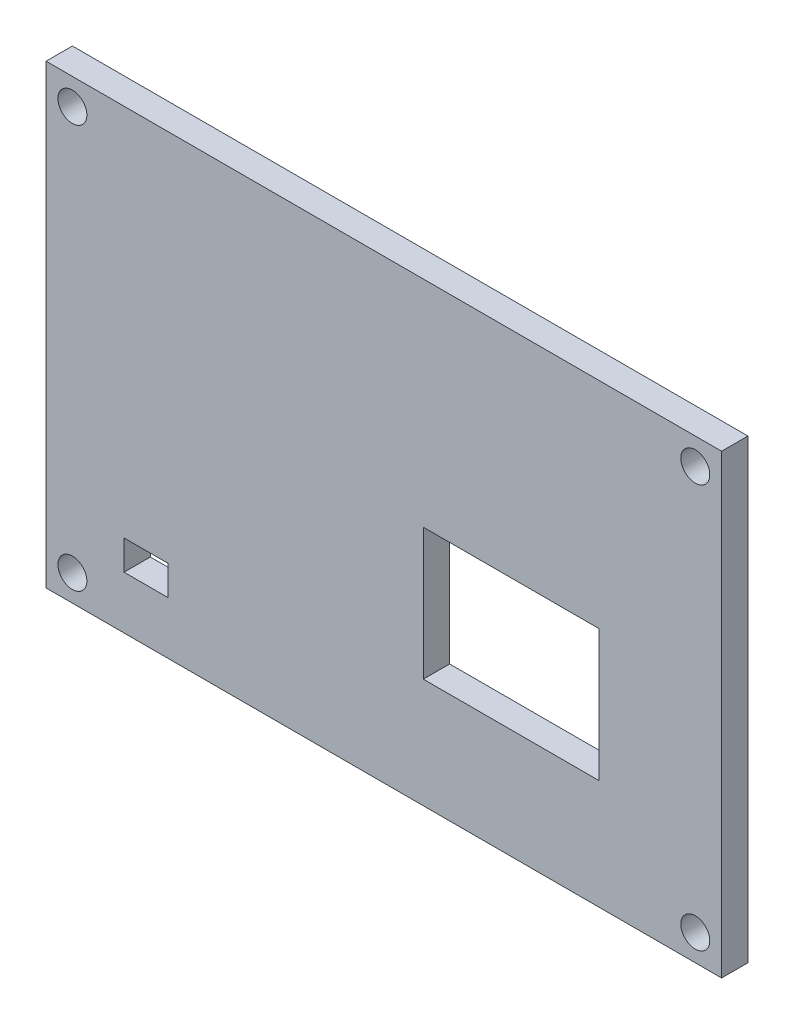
SolidWorks part; units mm, degrees
ref_plane "Alzado" through (0, 0, 0) normal (0, 0, 1) x (1, 0, 0)
ref_plane "Planta" through (0, 0, 0) normal (0, 1, 0) x (1, 0, 0)
ref_plane "Vista lateral" through (0, 0, 0) normal (1, 0, 0) x (0, 0, -1)
sketch "Croquis1" plane through (0, 0, 0) normal (0, 0, 1) x (1, 0, 0)
  line L0 (0, 0) -> (17.082, 0) construction
  line L1 (-38.5, -26) -> (38.5, -26)
  line L2 (-38.5, -26) -> (-38.5, 26)
  line L3 (-38.5, 26) -> (38.5, 26)
  line L4 (38.5, -26) -> (38.5, 26)
  line L5 (-38.5, -26) -> (38.5, 26) construction
  line L6 (-38.5, 26) -> (38.5, -26) construction
  line L7 (0, 0) -> (0, 14.9342) construction
  line L13 (-6, -2.5) -> (6, 2.5) construction
  line L14 (-6, 2.5) -> (6, -2.5) construction
  line L15 (24.5, -13.5) -> (4.5, -13.5)
  line L16 (24.5, -13.5) -> (24.5, 1.5)
  line L17 (24.5, 1.5) -> (4.5, 1.5)
  line L18 (4.5, -13.5) -> (4.5, 1.5)
  line L19 (-29.6154, -20) -> (-24.6079, -20)
  line L20 (-29.6154, -20) -> (-29.6154, -16.6183)
  line L21 (-29.6154, -16.6183) -> (-24.6079, -16.6183)
  line L22 (-24.6079, -20) -> (-24.6079, -16.6183)
  circle A0 centre (-35.5, 23) radius 1.65
  circle A1 centre (35.5, 23) radius 1.65
  circle A2 centre (35.5, -23) radius 1.65
  circle A3 centre (-35.5, -23) radius 1.65
  point P0 (0, 0)
  dimension "D4" = 3.3
  dimension "D1" = 52
  dimension "D2" = 77
  dimension "D3" = 3
  dimension "D5" = 3
  dimension "D6" = 14
  dimension "D7" = 12.5
  dimension "D8" = 20
  dimension "D9" = 6
  dimension "15" = 15
extrude "Saliente-Extruir1" add sketch "Croquis1" along normal blind 3
